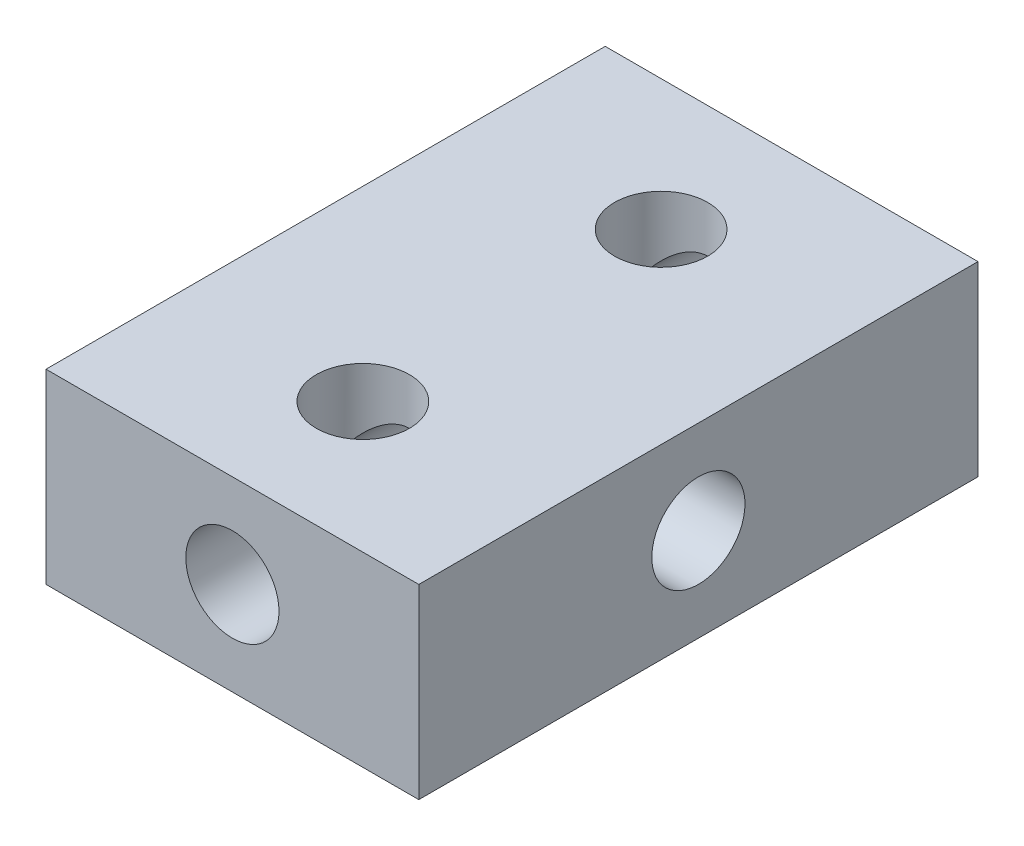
SolidWorks part; units mm, degrees
ref_plane "Plan de face" through (0, 0, 0) normal (0, 0, 1) x (1, 0, 0)
ref_plane "Plan de dessus" through (0, 0, 0) normal (0, 1, 0) x (1, 0, 0)
ref_plane "Plan de droite" through (0, 0, 0) normal (1, 0, 0) x (0, 0, -1)
sketch "Esquisse1" plane through (0, 0, 0) normal (0, 0, 1) x (1, 0, 0)
  line L1 (0, 5) -> (10, 5)
  line L2 (0, 5) -> (0, 0)
  line L3 (0, 0) -> (10, 0)
  line L4 (10, 5) -> (10, 0)
  dimension "D1" = 10
  dimension "D2" = 5
extrude "Extrusion1" add sketch "Esquisse1" along normal blind 15
hole_wizard "Trou taraudé M31" positions "Esquisse3" profile "Esquisse2" tap size "M3" standard "ISO"
sketch "Esquisse3" plane through (0, 0, 15) normal (0, 0, 1) x (1, 0, 0)
  line L0 (0, 5) -> (10, 0) construction
  point P0 (5, 2.5)
sketch "Esquisse2" plane through (5, 2.5, 15) normal (1, 0, 0) x (0, -1, 0)
  line L0 (0, 0) -> (0, 15)
  line L1 (0, 15) -> (1.25, 15)
  line L2 (1.25, 15) -> (1.25, 0)
  line L5 (1.25, 0) -> (0, 0)
  line L11 (0, -6.35) -> (0, 107.95) construction
  dimension "Diamètre du trou pour taraudage jusqu'au prochain" = 2.5
  dimension "Profondeur du trou pour taraudage jusqu'au prochain" = 15
hole_wizard "Trou taraudé M32" positions "Esquisse5" profile "Esquisse6" tap size "M3" standard "ISO"
sketch "Esquisse5" plane through (10, 0, 0) normal (1, 0, 0) x (0, 0, -1)
  line L0 (-15, 5) -> (0, 0) construction
  point P0 (-7.5, 2.5)
sketch "Esquisse6" plane through (10, 2.5, 7.5) normal (0, 1, 0) x (0, 0, -1)
  line L0 (0, 0) -> (0, 10)
  line L1 (0, 10) -> (1.25, 10)
  line L2 (1.25, 10) -> (1.25, 0)
  line L5 (1.25, 0) -> (0, 0)
  line L11 (0, -6.35) -> (0, 107.95) construction
  dimension "Diamètre du trou pour taraudage jusqu'au prochain" = 2.5
  dimension "Profondeur du trou pour taraudage jusqu'au prochain" = 10
hole_wizard "Trou taraudé M33" positions "Esquisse8" profile "Esquisse7" tap size "M3" standard "ISO"
sketch "Esquisse8" plane through (0, 5, 0) normal (0, 1, 0) x (-1, 0, 0)
  line L0 (-5, 15) -> (-5, 0) construction
  line L1 (-10, 15) -> (0, 15) construction
  line L2 (-10, 0) -> (0, 0) construction
  point P0 (-5, 11.5)
  point P1 (-5, 3.5)
  dimension "D1" = 8
  dimension "D2" = 3.5
sketch "Esquisse7" plane through (5, 5, 11.5) normal (1, 0, 0) x (0, 0, 1)
  line L0 (0, 0) -> (0, 5)
  line L1 (0, 5) -> (1.25, 5)
  line L2 (1.25, 5) -> (1.25, 0)
  line L5 (1.25, 0) -> (0, 0)
  line L11 (0, -6.35) -> (0, 107.95) construction
  dimension "Diamètre du trou pour taraudage jusqu'au prochain" = 2.5
  dimension "Profondeur du trou pour taraudage jusqu'au prochain" = 5
